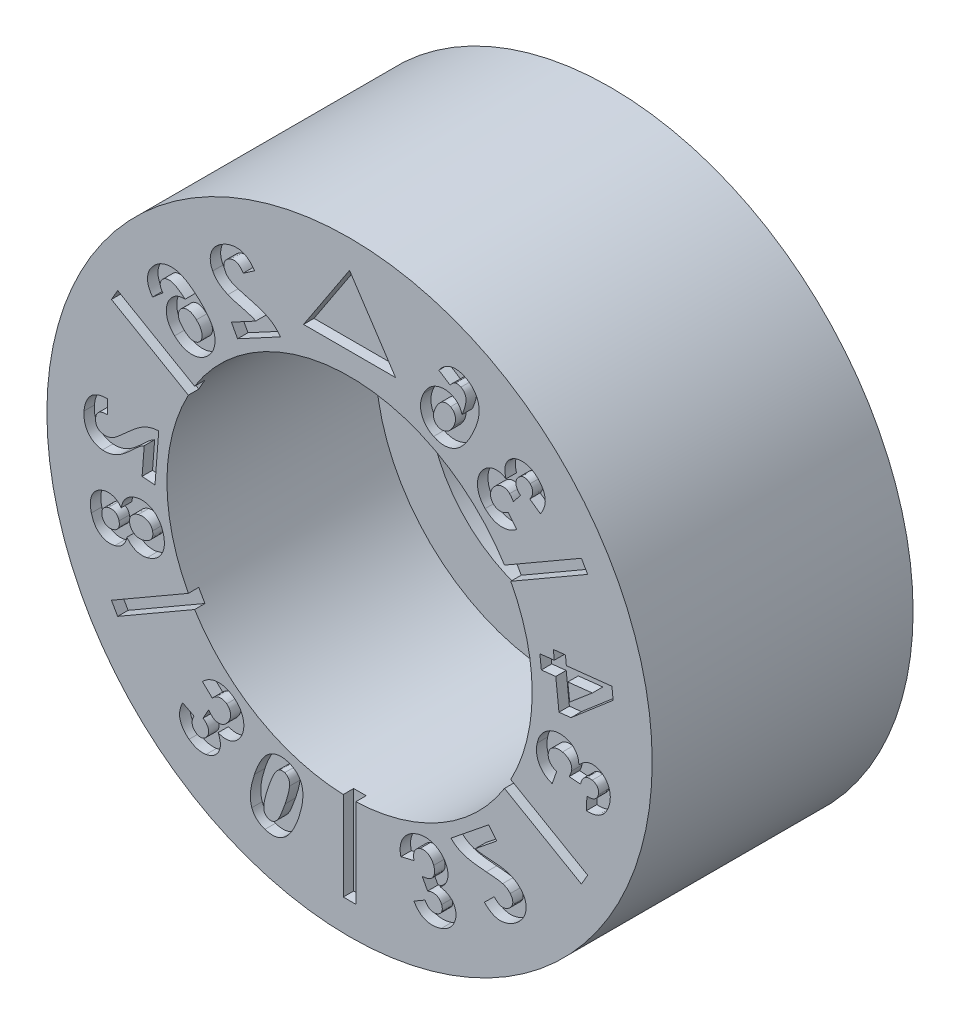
SolidWorks part; units mm, degrees
ref_plane "Front Plane" through (0, 0, 0) normal (0, 0, 1) x (1, 0, 0)
ref_plane "Top Plane" through (0, 0, 0) normal (0, 1, 0) x (1, 0, 0)
ref_plane "Right Plane" through (0, 0, 0) normal (1, 0, 0) x (0, 0, -1)
imported_body "Imported1"
other "Move Face2" parameters "D1"=0.157
other "DeleteFace1"
sketch "Sketch1" plane through (0, 0, 0) normal (0, 0, 1) x (1, 0, 0)
  line L0 (0, 0) -> (0, -3.3409) construction
  line L1 (0, 0) -> (-1.6705, -2.8933) construction
  line L3 (-0.06, -1.5) -> (0.06, -1.5)
  line L4 (-0.06, -1.5) -> (-0.06, -2.6)
  line L5 (-0.06, -2.6) -> (0.06, -2.6)
  line L6 (0.06, -1.5) -> (0.06, -2.6)
  line L11 (0, 0) -> (-2.8933, -1.6705) construction
  line L12 (-1.329, -0.698) -> (-1.269, -0.802)
  line L13 (-1.269, -0.802) -> (-2.2217, -1.352)
  line L14 (-1.329, -0.698) -> (-2.2817, -1.248)
  line L15 (-2.2817, -1.248) -> (-2.2217, -1.352)
  line L16 (0, 0) -> (-3.3409, 0) construction
  line L21 (0, 0) -> (-2.8933, 1.6705) construction
  line L22 (-1.269, 0.802) -> (-1.329, 0.698)
  line L23 (-1.329, 0.698) -> (-2.2817, 1.248)
  line L24 (-1.269, 0.802) -> (-2.2217, 1.352)
  line L25 (-2.2217, 1.352) -> (-2.2817, 1.248)
  line L26 (0, 0) -> (-1.6705, 2.8933) construction
  line L31 (0, 0) -> (0, 3.3409) construction
  line L36 (0, 0) -> (1.6705, 2.8933) construction
  line L41 (0, 0) -> (2.8933, 1.6705) construction
  line L42 (1.329, 0.698) -> (1.269, 0.802)
  line L43 (1.269, 0.802) -> (2.2217, 1.352)
  line L44 (1.329, 0.698) -> (2.2817, 1.248)
  line L45 (2.2817, 1.248) -> (2.2217, 1.352)
  line L46 (0, 0) -> (3.3409, 0) construction
  line L51 (0, 0) -> (2.8933, -1.6705) construction
  line L52 (1.269, -0.802) -> (1.329, -0.698)
  line L53 (1.329, -0.698) -> (2.2817, -1.248)
  line L54 (1.269, -0.802) -> (2.2217, -1.352)
  line L55 (2.2217, -1.352) -> (2.2817, -1.248)
  line L56 (0, 0) -> (1.6705, -2.8933) construction
  line L61 (0.06, 1.5) -> (0.06, 2.6)
  line L62 (-0.06, 1.5) -> (-0.06, 2.6)
  line L63 (0.06, 1.5) -> (-0.06, 1.5)
  line L64 (0.06, 2.6) -> (-0.06, 2.6)
  line L65 (0.802, 1.269) -> (1.352, 2.2217)
  line L66 (0.698, 1.329) -> (1.248, 2.2817)
  line L67 (1.352, 2.2217) -> (1.248, 2.2817)
  line L68 (0.802, 1.269) -> (0.698, 1.329)
  line L69 (-0.698, 1.329) -> (-1.248, 2.2817)
  line L70 (-1.248, 2.2817) -> (-1.352, 2.2217)
  line L71 (-0.802, 1.269) -> (-1.352, 2.2217)
  line L72 (-0.698, 1.329) -> (-0.802, 1.269)
  line L73 (1.5, 0.06) -> (2.6, 0.06)
  line L74 (1.5, -0.06) -> (2.6, -0.06)
  line L75 (1.5, -0.06) -> (1.5, 0.06)
  line L76 (2.6, -0.06) -> (2.6, 0.06)
  line L77 (-1.5, 0.06) -> (-2.6, 0.06)
  line L78 (-1.5, -0.06) -> (-2.6, -0.06)
  line L79 (-1.5, 0.06) -> (-1.5, -0.06)
  line L80 (-2.6, 0.06) -> (-2.6, -0.06)
  line L81 (0.802, -1.269) -> (1.352, -2.2217)
  line L82 (0.698, -1.329) -> (1.248, -2.2817)
  line L83 (-0.698, -1.329) -> (-1.248, -2.2817)
  line L84 (-0.802, -1.269) -> (-1.352, -2.2217)
  line L85 (-0.802, -1.269) -> (-0.698, -1.329)
  line L86 (0.698, -1.329) -> (0.802, -1.269)
  line L87 (1.248, -2.2817) -> (1.352, -2.2217)
  line L88 (-1.352, -2.2217) -> (-1.248, -2.2817)
  arc A0 (-0.6417, 1.7581) -> (0, 1.8715) centre (0, 0) ccw construction
  text T0 "26  28  30  32  34  36" font "Arial" height 0.7
  point P66 (0, 0)
  dimension "D1" = 3.743
  dimension "D6" = 12
extrude "Cut-Extrude1" cut sketch "Sketch1" against normal blind 0.1
other "Move Face3" parameters "D1"=0.5
sketch "Sketch2" plane through (0, 0, 0) normal (0, 1, 0) x (1, 0, 0)
  line L0 (2.9, 2.5) -> (-2.9, 2.5) construction
  line L1 (-1.8, 2.5) -> (-2.2, 2.5)
  arc A0 (-2.2, 2.5) -> (-1.8, 2.5) centre (-2, 2.5) cw
  dimension "D2" = 0.2
  dimension "D1" = 2
revolve "Revolve1" add sketch "Sketch2" angle 360 about L1
